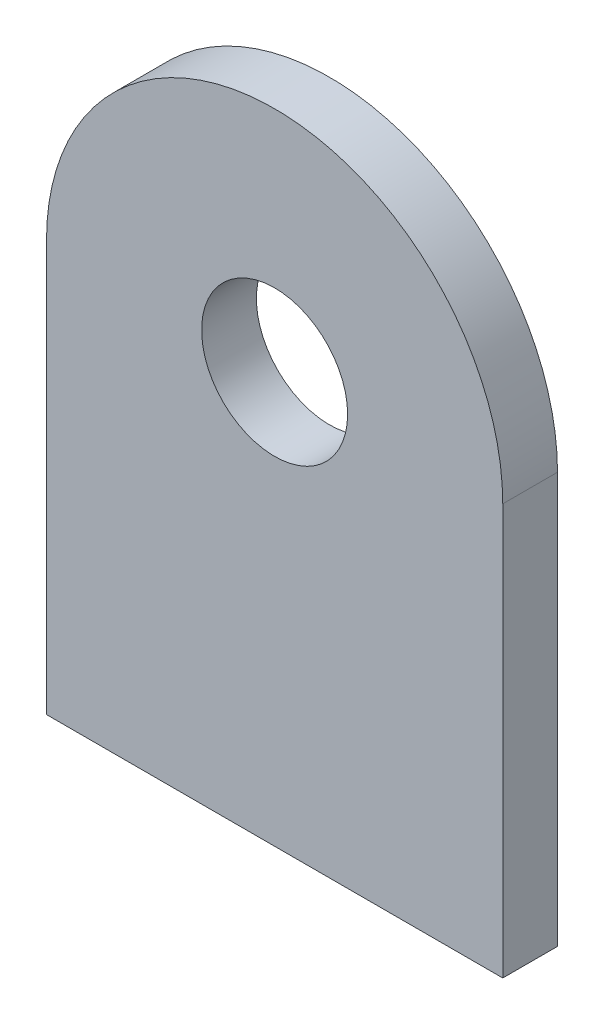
SolidWorks part; units mm, degrees
ref_plane "Plan de face" through (0, 0, 0) normal (0, 0, 1) x (1, 0, 0)
ref_plane "Plan de dessus" through (0, 0, 0) normal (0, 1, 0) x (1, 0, 0)
ref_plane "Plan de droite" through (0, 0, 0) normal (1, 0, 0) x (0, 0, -1)
sketch "Esquisse1" plane through (0, 0, 0) normal (0, 0, 1) x (1, 0, 0)
  line L0 (-12.5, 0) -> (12.5, 0)
  line L1 (12.5, 0) -> (12.5, 22.5)
  line L2 (-12.5, 22.5) -> (-12.5, 0)
  arc A0 (12.5, 22.5) -> (-12.5, 22.5) centre (0, 22.5) ccw
  point P6 (0, 0)
  dimension "D2" = 35
  dimension "D1" = 25
extrude "Boss.-Extru.1" add sketch "Esquisse1" along normal blind 3
sketch "Esquisse4" plane through (0, 0, 3) normal (0, 0, 1) x (1, 0, 0)
  circle A0 centre (0, 22.5) radius 4
  dimension "D1" = 8
extrude "Enlèv. mat.-Extru.1" cut sketch "Esquisse4" against normal through all
